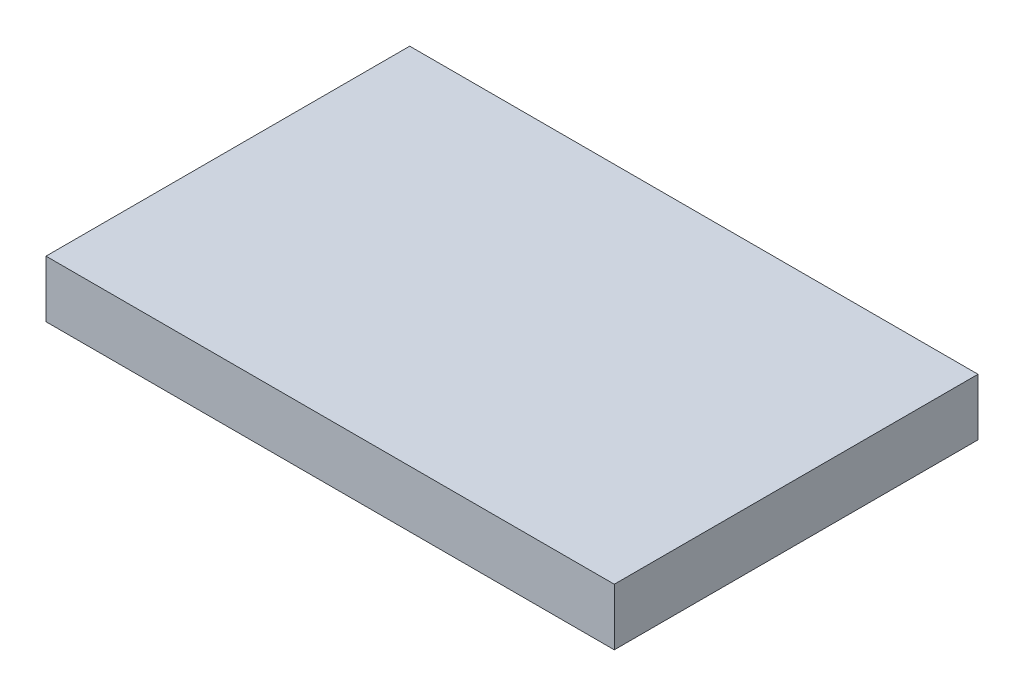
SolidWorks part; units mm, degrees
ref_plane "Спереди" through (0, 0, 0) normal (0, 0, 1) x (1, 0, 0)
ref_plane "Сверху" through (0, 0, 0) normal (0, 1, 0) x (1, 0, 0)
ref_plane "Справа" through (0, 0, 0) normal (1, 0, 0) x (0, 0, -1)
sketch "Эскиз1" plane through (0, 0, 0) normal (0, 1, 0) x (1, 0, 0)
  line L1 (0, 0) -> (100, 0)
  line L2 (0, 0) -> (0, 64)
  line L3 (0, 64) -> (100, 64)
  line L4 (100, 0) -> (100, 64)
extrude "Бобышка-Вытянуть1" add sketch "Эскиз1" along normal blind 10
